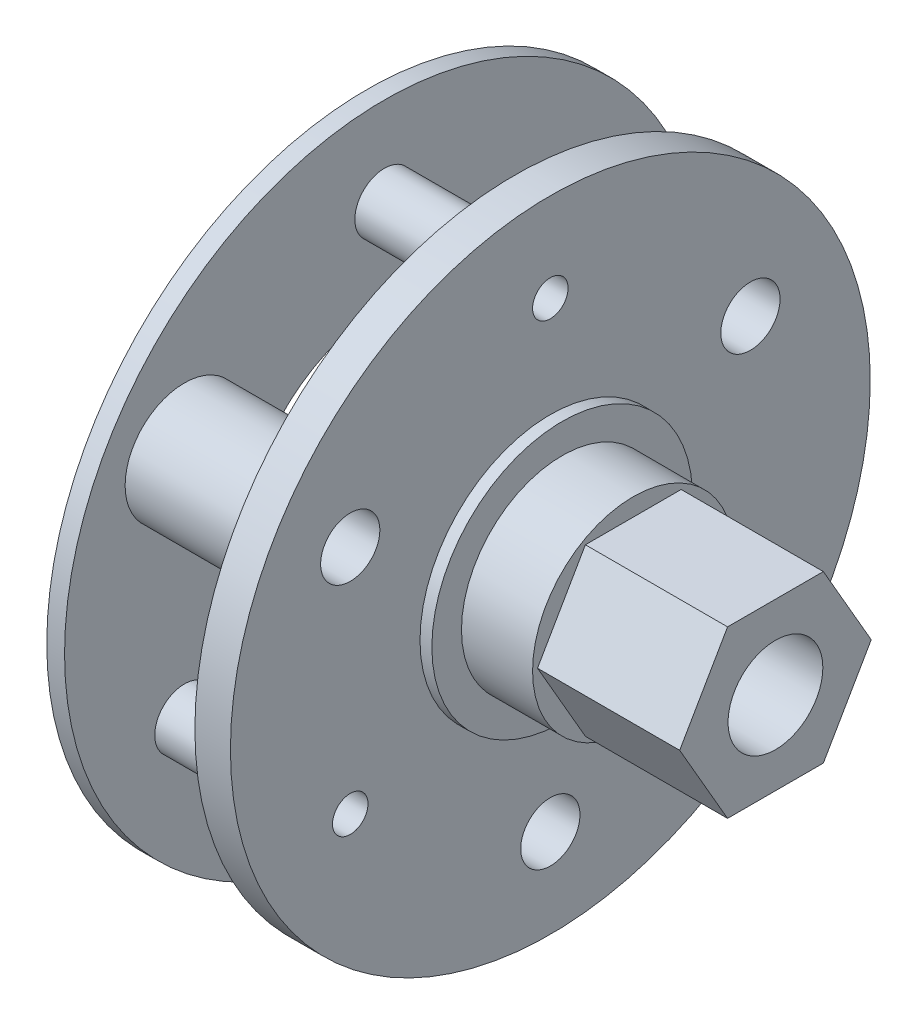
SolidWorks part; units mm, degrees
ref_plane "Plan1" through (0, 0, 0) normal (0, 0, 1) x (1, 0, 0)
ref_plane "Plan2" through (0, 0, 0) normal (0, 1, 0) x (1, 0, 0)
ref_plane "Plan3" through (0, 0, 0) normal (1, 0, 0) x (0, 0, -1)
sketch "Esquisse1" plane through (0, 0, 0) normal (0, 0, 1) x (1, 0, 0)
  line L0 (0, 0) -> (103, 0) construction
  line L1 (0, 0) -> (0, 64) construction
  line L2 (0, 0) -> (0, 27)
  line L3 (0, 27) -> (3, 27)
  line L4 (3, 27) -> (3, 11)
  line L5 (4, 8.5) -> (22, 8.5)
  line L6 (22, 8.5) -> (22, 0)
  line L7 (3, 11) -> (4, 11)
  line L8 (4, 11) -> (4, 8.5)
  line L9 (0, 0) -> (22, 0)
  dimension "D1" = 54
  dimension "D2" = 17
  dimension "D3" = 3
  dimension "D4" = 22
  dimension "D5" = 1
  dimension "D6" = 18
revolve "Base-Révolution" add sketch "Esquisse1" angle 360 about L0
sketch "Esquisse2" plane through (0, 0, 0) normal (-1, 0, 0) x (0, 0, 1)
  line L0 (0, 0) -> (0, 41.0488) construction
  line L1 (0, 0) -> (-30.692, -17.72) construction
  line L2 (0, 0) -> (24.7689, -14.3003) construction
  line L3 (0, 0) -> (35.1675, 20.3039) construction
  circle A0 centre (0, 0) radius 19.5 construction
  circle A1 centre (0, 19.5) radius 1.5
  circle A2 centre (0, 19.5) radius 2.5
  circle A3 centre (16.8875, 9.75) radius 2.5
  circle A4 centre (16.8875, 9.75) radius 5
  dimension "D1" = 39
  dimension "D4" = 5
  dimension "D5" = 3
  dimension "D6" = 10
  dimension "D7" = 5
  dimension "D2" = 120
  dimension "D3" = 120
extrude "Boss.-Extru.2" add sketch "Esquisse2" along normal blind 11
pattern_circular "Répétition circulaire1" count 3 over 360 about axis through (0, 0, 0) along (1, 0, 0)
sketch "Esquisse3" plane through (-11, 0, 0) normal (-1, 0, 0) x (0, 0, 1)
  circle A0 centre (0, 0) radius 27 construction
  circle A1 centre (0, 0) radius 27
  circle A2 centre (0, 0) radius 12
  dimension "D1" = 24
extrude "Boss.-Extru.3" add sketch "Esquisse3" along normal blind 1.5
sketch "Esquisse4" plane through (22, 0, 0) normal (1, 0, 0) x (0, 0, -1)
  circle A0 centre (0, 0) radius 4
  dimension "D1" = 8
extrude "Enlèv. mat.-Extru.1" cut sketch "Esquisse4" against normal through all
sketch "Esquisse5" plane through (3, 0, 0) normal (1, 0, 0) x (0, 0, -1)
  circle A0 centre (0, 19.5) radius 1.5 construction
  circle A1 centre (0, 19.5) radius 1.5
  circle A2 centre (16.8875, 9.75) radius 2.5 construction
  circle A3 centre (16.8875, 9.75) radius 2.5
extrude "Enlèv. mat.-Extru.2" cut sketch "Esquisse5" against normal through all
pattern_circular "Répétition circulaire2" count 3 over 360 about axis through (0, 0, 0) along (1, 0, 0)
sketch "Esquisse6" plane through (22, 0, 0) normal (1, 0, 0) x (0, 0, -1)
  line L1 (8.0829, 0) -> (4.0415, 7)
  line L2 (4.0415, 7) -> (-4.0415, 7)
  line L3 (-4.0415, 7) -> (-8.0829, 0)
  line L4 (-8.0829, 0) -> (-4.0415, -7)
  line L5 (-4.0415, -7) -> (4.0415, -7)
  line L6 (4.0415, -7) -> (8.0829, 0)
  circle A0 centre (0, 0) radius 7 construction
  circle A1 centre (0, 0) radius 11.1803
  dimension "D1" = 14
extrude "Enlèv. mat.-Extru.4" cut sketch "Esquisse6" against normal blind 12
